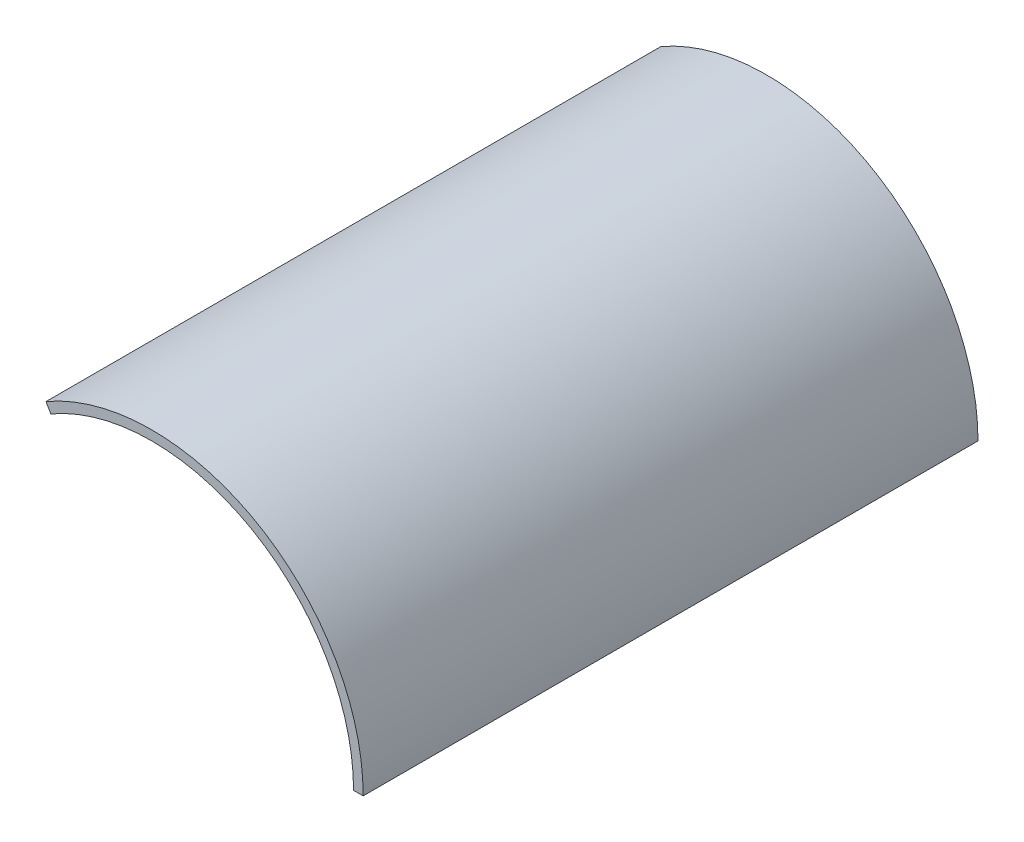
SolidWorks part; units mm, degrees
ref_plane "Alzado" through (0, 0, 0) normal (0, 0, 1) x (1, 0, 0)
ref_plane "Planta" through (0, 0, 0) normal (0, 1, 0) x (1, 0, 0)
ref_plane "Vista lateral" through (0, 0, 0) normal (1, 0, 0) x (0, 0, -1)
sketch "Croquis1" plane through (0, 0, 0) normal (0, 0, 1) x (1, 0, 0)
  line L0 (0, 0) -> (11, 0)
  line L1 (0, 0) -> (-5.508, 9.5216)
  arc A0 (10.5, 0) -> (-5.2577, 9.0888) centre (0, 0) ccw
  arc A1 (11, 0) -> (-5.508, 9.5216) centre (0, 0) ccw
  dimension "D1" = 21
  dimension "D2" = 0.5
  dimension "D3" = 120.048
extrude "Saliente-Extruir1" add sketch "Croquis1" along normal blind 32 contours L0 A1 L1 A0
